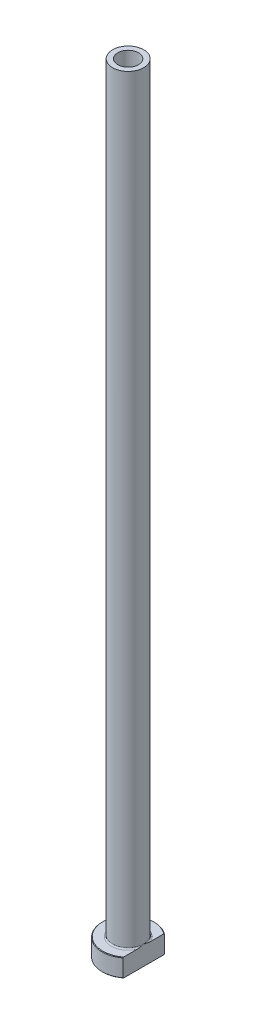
SolidWorks part; units mm, degrees
ref_plane "Front Plane" through (0, 0, 0) normal (0, 0, 1) x (1, 0, 0)
ref_plane "Top Plane" through (0, 0, 0) normal (0, 1, 0) x (1, 0, 0)
ref_plane "Right Plane" through (0, 0, 0) normal (1, 0, 0) x (0, 0, -1)
sketch "Sketch1" plane through (0, 0, 0) normal (0, 0, 1) x (1, 0, 0)
  line L0 (-4, 300) -> (-6, 300)
  line L1 (-6, 300) -> (-6, 7)
  line L2 (-6, 7) -> (-10, 7)
  line L3 (-10, 7) -> (-10, 0)
  line L4 (8.8, 0) -> (-8.8, 0) construction
  line L5 (-10, 0) -> (-4.25, 0)
  line L6 (-4, 255) -> (-4, 300)
  line L7 (0, 92.1877) -> (0, -15.5353) construction
  line L8 (0, -11) -> (0, 11) construction
  line L9 (-4, 255) -> (-4.25, 243)
  line L10 (-4.25, 243) -> (-4.25, 0)
  dimension "D1" = 0.25
  dimension "ID" = 8
  dimension "OD" = 12
  dimension "L" = 300
  dimension "H" = 20
  dimension "T" = 7
  dimension "N" = 45
  dimension "D2" = 12
  dimension "L-N" = 255
revolve "Revolve1" add sketch "Sketch1" angle 360 about L7
fillet "Fillet1" radius 0.5 1 edges at (0, 7, 6)
chamfer "Chamfer1" distance 0.2 angle 45 2 edges at (0, 7, 10) (0, 0, 10)
sketch "Sketch2" plane through (0, 0, 0) normal (0, -1, 0) x (1, 0, 0)
  line L0 (6, 8) -> (6, -8)
  circle A0 centre (0, 0) radius 10 construction
  arc A1 (6, 8) -> (6, -8) centre (0, 0) cw
  circle A2 centre (0, 0) radius 6 construction
extrude "Cut-Extrude1" cut sketch "Sketch2" against normal through all
chamfer "Chamfer2" distance 0.5 angle 45 1 edges at (0, 0, 4.25)
